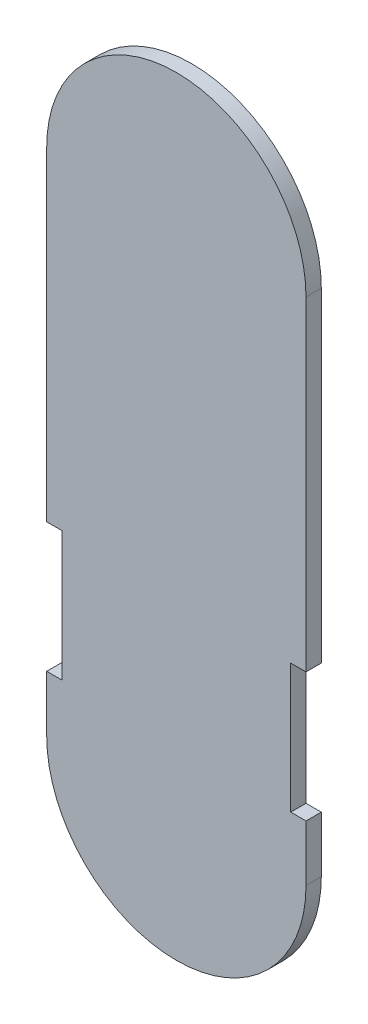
SolidWorks part; units mm, degrees
ref_plane "Front Plane" through (0, 0, 0) normal (0, 0, 1) x (1, 0, 0)
ref_plane "Top Plane" through (0, 0, 0) normal (0, 1, 0) x (1, 0, 0)
ref_plane "Right Plane" through (0, 0, 0) normal (1, 0, 0) x (0, 0, -1)
sketch "Sketch1" plane through (0, 0, 0) normal (0, 0, 1) x (1, 0, 0)
  line L0 (13.1287, 8.7099) -> (13.1287, -42.0901) construction
  line L1 (0.206, -36.5181) -> (0.206, -42.0901)
  line L2 (26.0515, 8.7099) -> (26.0515, -23.6504)
  line L3 (0.206, 8.7099) -> (0.206, -23.6212)
  line L4 (26.0515, -23.6504) -> (24.5275, -23.6504)
  line L6 (26.0515, -36.5154) -> (24.5275, -36.5154)
  line L7 (24.5275, -23.6504) -> (24.5275, -36.5154)
  line L8 (1.7253, -36.5181) -> (0.206, -36.5181)
  line L9 (1.7253, -36.5181) -> (1.7253, -23.6212)
  line L10 (1.7253, -23.6212) -> (0.206, -23.6212)
  line L11 (26.0515, -36.5154) -> (26.0515, -42.0901)
  arc A0 (26.0515, 8.7099) -> (0.206, 8.7099) centre (13.1287, 8.7099) ccw
  arc A1 (0.206, -42.0901) -> (26.0515, -42.0901) centre (13.1287, -42.0901) ccw
  point P4 (13.1287, -16.6901)
extrude "Boss-Extrude1" add sketch "Sketch1" along normal blind 1.524
